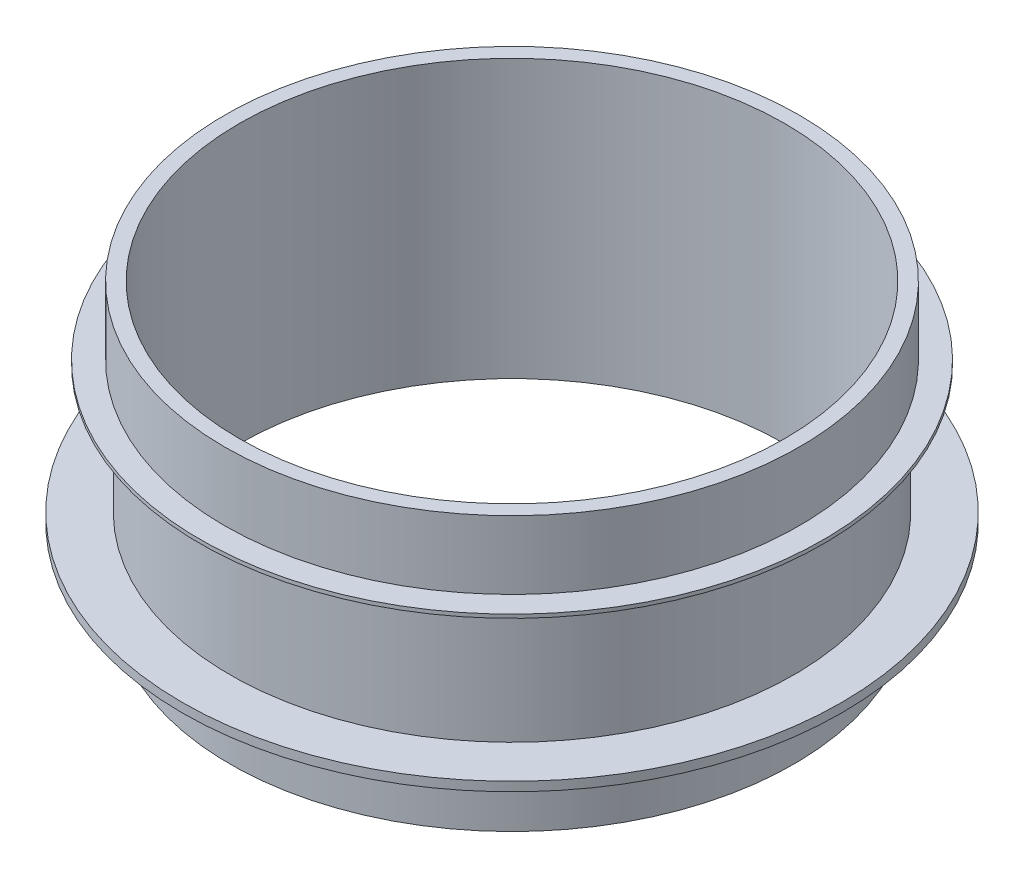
SolidWorks part; units mm, degrees
ref_plane "Plan de face" through (0, 0, 0) normal (0, 0, 1) x (1, 0, 0)
ref_plane "Plan de dessus" through (0, 0, 0) normal (0, 1, 0) x (1, 0, 0)
ref_plane "Plan de droite" through (0, 0, 0) normal (1, 0, 0) x (0, 0, -1)
sketch "Esquisse1" plane through (0, 0, 0) normal (0, 1, 0) x (1, 0, 0)
  circle A0 centre (0, 0) radius 62
  circle A1 centre (0, 0) radius 60
  dimension "D1" = 124
  dimension "D2" = 2
extrude "Extrusion1" add sketch "Esquisse1" along normal blind 61
ref_plane "Plan1" through (0, 15, 0) normal (0, -1, 0) x (1, 0, 0)
sketch "Esquisse2" plane through (0, 15, 0) normal (0, -1, 0) x (1, 0, 0)
  circle A0 centre (0, 0) radius 72.5
  circle A1 centre (0, 0) radius 62
  circle A2 centre (0, 0) radius 62 construction
  dimension "D1" = 145
extrude "Extrusion2" add sketch "Esquisse2" against normal blind 2
sketch "Esquisse4" plane through (0, 61, 0) normal (0, 1, 0) x (-1, 0, 0)
  circle A0 centre (0, 0) radius 60
  circle A1 centre (0, 0) radius 63.2
  circle A2 centre (0, 0) radius 60 construction
  dimension "D1" = 3.2
extrude "Extrusion3" add sketch "Esquisse4" against normal blind 15
sketch "Esquisse5" plane through (0, 46, 0) normal (0, -1, 0) x (1, 0, 0)
  circle A0 centre (0, 0) radius 68.5
  circle A1 centre (0, 0) radius 63.2
  circle A2 centre (0, 0) radius 63.2 construction
  dimension "D1" = 137
extrude "Extrusion4" add sketch "Esquisse5" along normal blind 0.8
